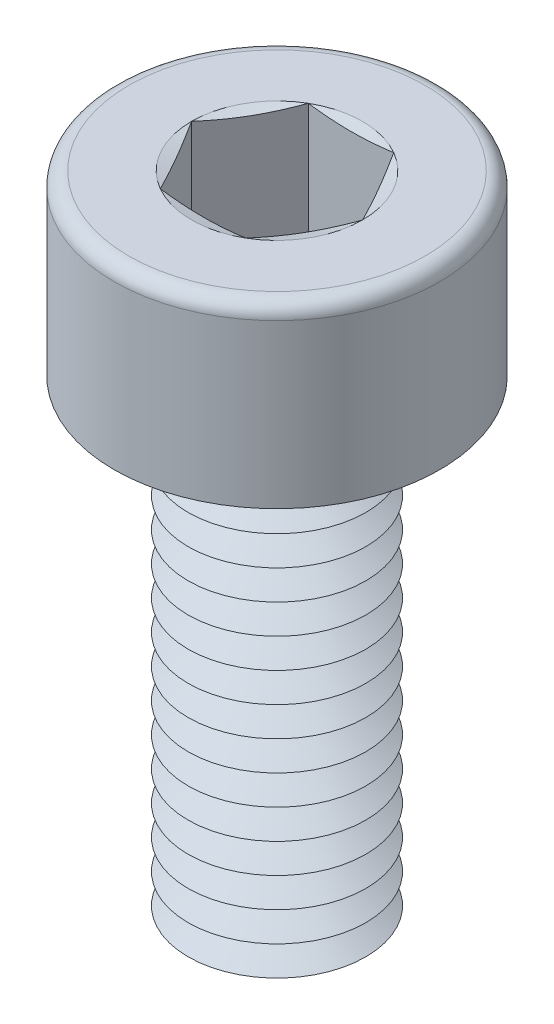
SolidWorks part; units mm, degrees
ref_plane "Front Plane" through (0, 0, 0) normal (0, 0, 1) x (1, 0, 0)
ref_plane "Top Plane" through (0, 0, 0) normal (0, 1, 0) x (1, 0, 0)
ref_plane "Right Plane" through (0, 0, 0) normal (1, 0, 0) x (0, 0, -1)
sketch "Sketch1" plane through (0, 0, 0) normal (0, 1, 0) x (1, 0, 0)
  circle A0 centre (0, 0) radius 1.5
  dimension "D1" = 3
extrude "Extrude1" add sketch "Sketch1" along normal blind 8
sketch "Sketch2" plane through (0, 8, 0) normal (0, 1, 0) x (1, 0, 0)
  circle A0 centre (0, 0) radius 2.75
  dimension "D1" = 5.5
extrude "Extrude2" add sketch "Sketch2" along normal blind 3
sketch "Sketch3" plane through (0, 11, 0) normal (0, 1, 0) x (1, 0, 0)
  line L1 (0.7217, 1.25) -> (-0.7217, 1.25)
  line L2 (-0.7217, 1.25) -> (-1.4434, 0)
  line L3 (-1.4434, 0) -> (-0.7217, -1.25)
  line L4 (-0.7217, -1.25) -> (0.7217, -1.25)
  line L5 (0.7217, -1.25) -> (1.4434, 0)
  line L6 (1.4434, 0) -> (0.7217, 1.25)
  circle A0 centre (0, 0) radius 1.25 construction
  dimension "D1" = 2.5
extrude "Extrude3" cut sketch "Sketch3" against normal blind 2.5
fillet "Fillet1" radius 0.25 1 edges at (0, 11, 2.75)
sketch "Sketch4" plane through (0, 0, 0) normal (1, 0, 0) x (0, 0, -1)
  line L0 (-1.25, 8.5) -> (0, 8.5)
  line L1 (0, 8.5) -> (0, 7.7783)
  line L2 (0, 7.7783) -> (-1.25, 8.5)
  dimension "D1" = 30
revolve "Cut-Revolve1" cut sketch "Sketch4" angle 360 about L1
sketch "Sketch5" plane through (0, 0, 0) normal (0, 0, 1) x (1, 0, 0)
  line L0 (-1.5, 0.25) -> (-1.5, -0.25)
  line L1 (-1.5, 8) -> (-1.5, 0) construction
  line L2 (-1.5, -0.25) -> (-1.067, 0)
  line L3 (-1.5, 0) -> (1.5, 0) construction
  line L4 (-1.067, 0) -> (-1.5, 0.25)
  dimension "D1" = 0.5
revolve "Cut-Revolve2" cut sketch "Sketch5" angle 360 about axis through (0, 8, 0) along (0, -1, 0)
pattern_linear "LPattern1" count 16 spacing 0.5 along (0, 1, 0) of "Cut-Revolve2"
sketch "Sketch6" plane through (0, 11, 0) normal (0, 1, 0) x (1, 0, 0)
  circle A0 centre (0, 0) radius 1.4434
extrude "Extrude4" cut sketch "Sketch6" against normal through all draft 75
